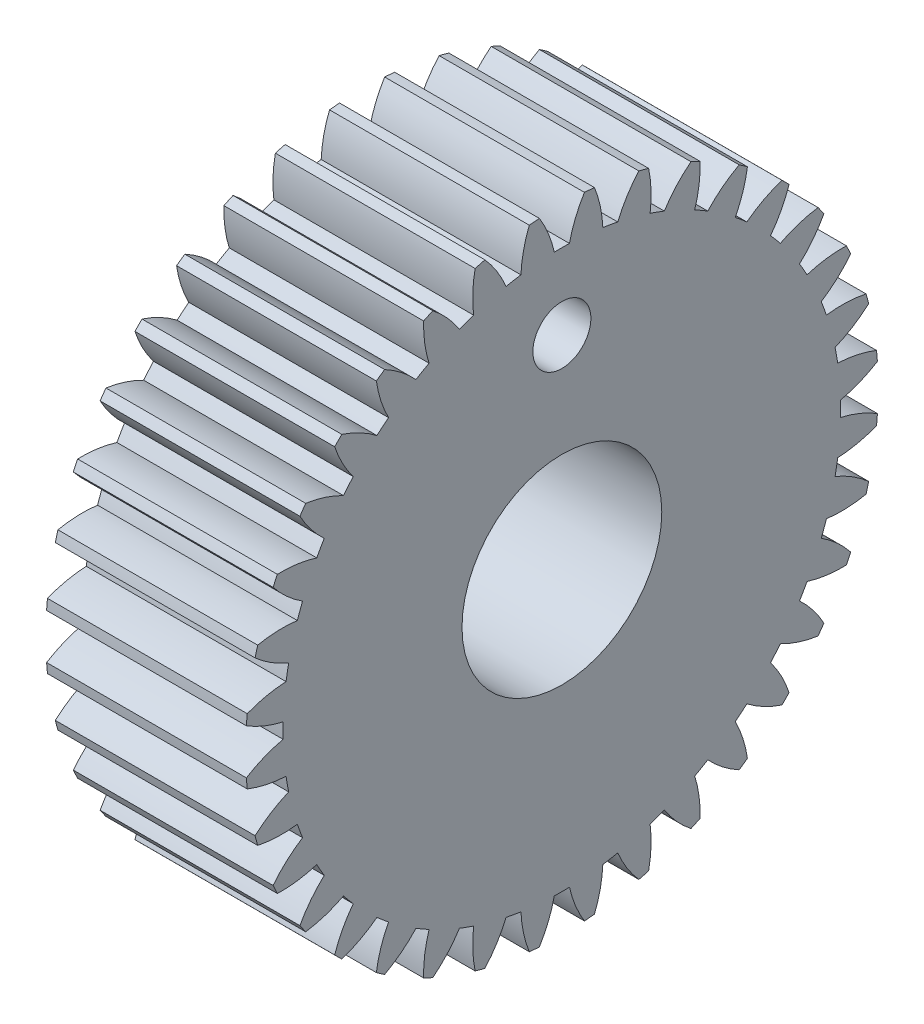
SolidWorks part; units mm, degrees
other "<Spur Gear_AM>-<Bore>"
ref_plane "Face" through (0, 0, 0) normal (0, 0, 1) x (1, 0, 0)
ref_plane "Dessus" through (0, 0, 0) normal (0, 1, 0) x (1, 0, 0)
ref_plane "Droite" through (0, 0, 0) normal (1, 0, 0) x (0, 0, -1)
inserted part "Spur Gear_AM"
sketch "Esquisse1" plane through (0, 0, 0) normal (-1, 0, 0) x (0, 0, 1)
  circle A0 centre (0, 12.2072) radius 1.7415
extrude "Enlèv. mat.-Extru.1" cut sketch "Esquisse1" against normal through all
sketch "Esquisse2" plane through (0, 0, 0) normal (-1, 0, 0) x (0, 0, 1)
  circle A0 centre (0, 0) radius 18
